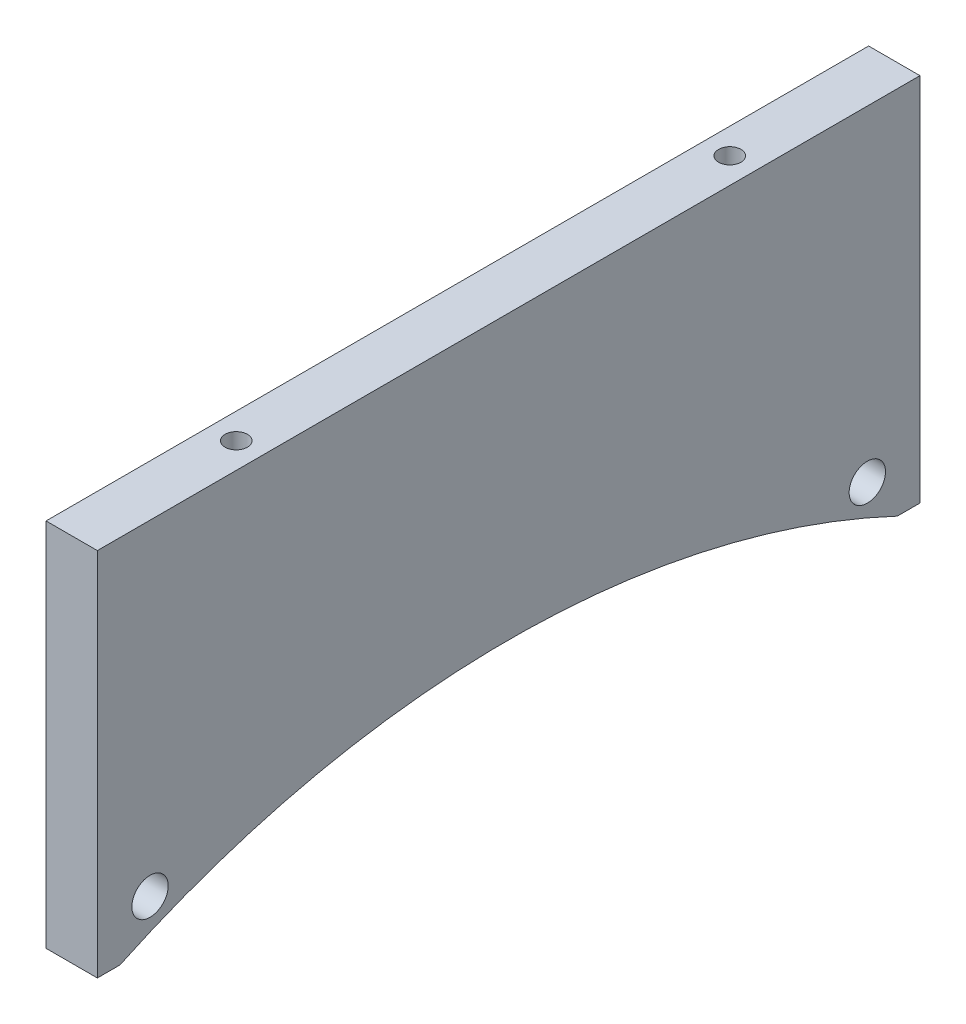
SolidWorks part; units mm, degrees
ref_plane "Front Plane" through (0, 0, 0) normal (0, 0, 1) x (1, 0, 0)
ref_plane "Top Plane" through (0, 0, 0) normal (0, 1, 0) x (1, 0, 0)
ref_plane "Right Plane" through (0, 0, 0) normal (1, 0, 0) x (0, 0, -1)
sketch "Sketch1" plane through (0, 0, 0) normal (1, 0, 0) x (0, 0, -1)
  line L0 (-76.074, -119.6847) -> (-76.074, 95.0777) construction
  line L2 (-12.574, 7.3153) -> (-12.574, 64.4653)
  line L3 (-12.574, 64.4653) -> (-139.574, 64.4653)
  line L4 (-139.574, 7.3153) -> (-139.574, 64.4653)
  line L5 (-139.574, 7.3153) -> (-136.0788, 7.3153)
  line L6 (-16.0692, 7.3153) -> (-12.574, 7.3153)
  arc A1 (-16.0692, 7.3153) -> (-136.0788, 7.3153) centre (-76.074, -119.6847) ccw
  dimension "D1" = 57.15
  dimension "D2" = 127
  dimension "D4" = 140.462
  dimension "D3" = 63.5
  dimension "D5" = 184.15
extrude "Boss-Extrude1" add sketch "Sketch1" along normal blind 7.9248
hole_wizard "CSK for #10 Flat Head Machine Screw1" positions "Sketch3" profile "Sketch2" countersink size "#10" standard "ANSI Inch"
sketch "Sketch3" plane through (0, 0, 0) normal (-1, 0, 0) x (0, 0, 1)
  arc A0 (136.0788, 7.3153) -> (16.0692, 7.3153) centre (76.074, -119.6847) ccw construction
  point P0 (20.702, 14.1733)
  point P2 (131.446, 14.1733)
  dimension "D1" = 133.858
  dimension "D2" = 55.372
  dimension "D3" = 55.372
sketch "Sketch2" plane through (0, 14.1733, 20.702) normal (0, 1, 0) x (0, 0, 1)
  line L0 (0, 0) -> (0, 7.9248)
  line L1 (0, 7.9248) -> (2.8067, 7.9248)
  line L2 (2.8067, 7.9248) -> (2.8067, 3.412)
  line L3 (2.8067, 3.412) -> (4.8895, 1.016)
  line L4 (4.8895, 1.016) -> (4.8895, 0)
  line L6 (4.8895, 0) -> (0, 0)
  line L7 (-2.8067, 3.412) -> (-4.8895, 1.016) construction
  line L11 (0, -6.35) -> (0, 107.95) construction
  dimension "Thru Hole Dia." = 5.6134
  dimension "Thru Hole Depth" = 7.9248
  dimension "C'Sink Dia." = 9.779
  dimension "C'Sink Angle" = 82
  dimension "Head Clearance" = 1.016
hole_wizard "#8-32 Tapped Hole1" positions "Sketch5" profile "Sketch4" tap size "#8-32" standard "ANSI Inch"
sketch "Sketch5" plane through (0, 64.4653, 0) normal (0, 1, 0) x (1, 0, 0)
  line L0 (7.9248, -12.574) -> (0, -12.574) construction
  line L1 (0, -12.574) -> (0, -139.574) construction
  point P0 (3.9624, -37.974)
  dimension "D1" = 25.4
  dimension "D2" = 3.9624
sketch "Sketch4" plane through (3.9624, 64.4653, 37.974) normal (1, 0, 0) x (0, 0, 1)
  line L0 (0, 0) -> (0, 11.1978)
  line L1 (0, 11.1978) -> (1.7272, 10.16)
  line L2 (1.7272, 10.16) -> (1.7272, 0)
  line L5 (1.7272, 0) -> (0, 0)
  line L10 (0, 11.1978) -> (-1.7272, 10.16) construction
  line L11 (0, -6.35) -> (0, 107.95) construction
  dimension "Tap Drill Dia." = 3.4544
  dimension "Tap Drill Depth" = 10.16
  dimension "Drill Angle" = 118
pattern_linear "LPattern1" count 2 spacing 76.2 along (0, 0, 1) of "#8-32 Tapped Hole1"
